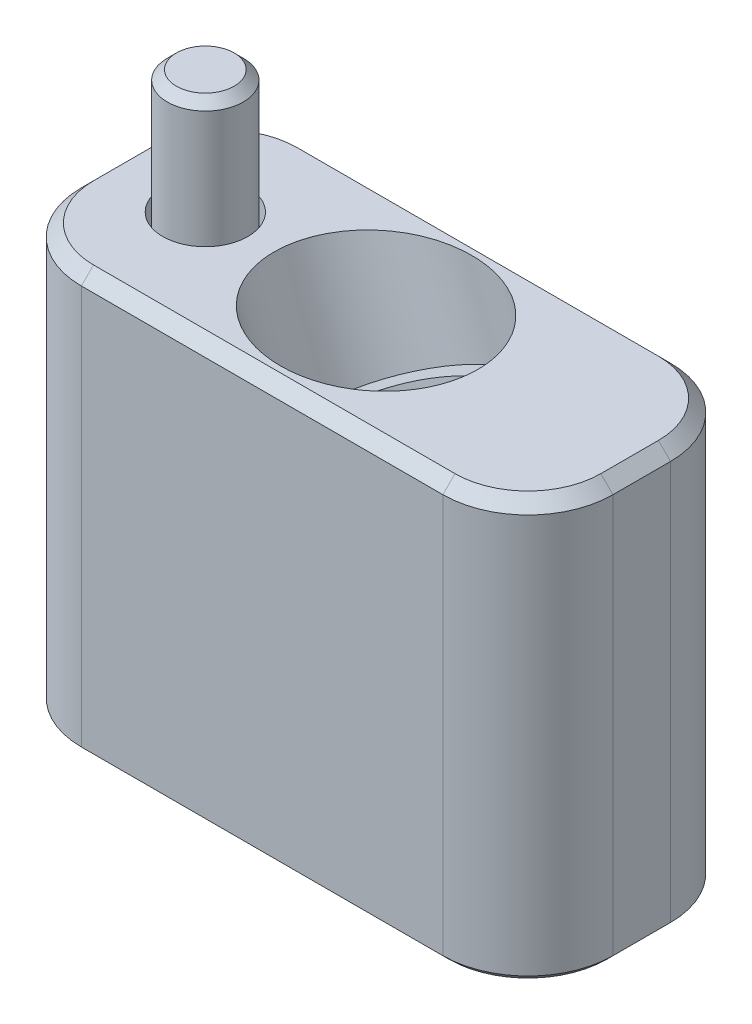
SolidWorks part; units mm, degrees
other "<SHCS25-20L1.50>-<Chamfer2>"
ref_plane "Front Plane" through (0, 0, 0) normal (0, 0, 1) x (1, 0, 0)
ref_plane "Top Plane" through (0, 0, 0) normal (0, 1, 0) x (1, 0, 0)
ref_plane "Right Plane" through (0, 0, 0) normal (1, 0, 0) x (0, 0, -1)
sketch "Sketch1" plane through (0, 0, 0) normal (0, 1, 0) x (1, 0, 0)
  line L1 (15.1003, -9.5186) -> (-15.113, -9.5186)
  line L2 (22.2123, -2.4066) -> (22.2123, 2.4067)
  line L3 (15.1003, 9.5187) -> (-15.113, 9.5186)
  line L4 (-22.225, -2.4066) -> (-22.225, 2.4066)
  line L5 (22.2123, -9.5186) -> (-22.225, 9.5186) construction
  line L6 (22.2123, 9.5187) -> (-22.225, -9.5187) construction
  arc A0 (15.1003, 9.5187) -> (22.2123, 2.4067) centre (15.1003, 2.4067) cw
  arc A1 (22.2123, -2.4066) -> (15.1003, -9.5186) centre (15.1003, -2.4066) cw
  arc A2 (-15.113, -9.5186) -> (-22.225, -2.4066) centre (-15.113, -2.4066) cw
  arc A3 (-22.225, 2.4066) -> (-15.113, 9.5186) centre (-15.113, 2.4066) cw
  point P0 (-0.0064, 0)
  dimension "D3" = 7.112
  dimension "D1" = 19.0373
  dimension "D2" = 44.4373
  dimension "D4" = 22.225
extrude "Boss-Extrude1" add sketch "Sketch1" against normal blind 34.8996
sketch "Sketch2" plane through (0, 0, 0) normal (0, 0, 1) x (1, 0, 0)
  line L0 (0, 0) -> (2.5121, -6.902) construction
  line L1 (-15.113, 0) -> (15.1003, 0) construction
  line L3 (0, -10.4705) -> (0, 10.4705) construction
  line L4 (-3.5178, -8.9569) -> (-5.0513, -9.5151)
  line L5 (-5.0513, -9.5151) -> (-18.2203, 26.6666)
  line L6 (-10.7018, 29.4031) -> (-18.2203, 26.6666)
  line L7 (-3.5178, -8.9569) -> (9.1724, -43.8228)
  line L8 (9.1724, -43.8228) -> (15.9502, -43.8228)
  line L9 (15.9502, -43.8228) -> (-10.7018, 29.4031)
  dimension "D1" = 20
  dimension "D2" = 12.7381
  dimension "D3" = 7.2136
  dimension "D4" = 8.001
revolve "Cut-Revolve1" cut sketch "Sketch2" angle 360 about L0
chamfer "Chamfer1" distance 1.016 angle 45 8 edges at (-0.0064, 0, -9.5186) (-20.1419, 0, -7.4356) (20.1292, 0, -7.4356) (-22.225, 0, 0) (22.2123, 0, 0) (-20.1419, 0, 7.4356) (20.1292, 0, 7.4356) (-0.0063, 0, 9.5186)
hole_wizard "CBORE for 1/4 Socket Head Cap Screw1" positions "Sketch3" profile "Sketch4" counterbore size "1/4" standard "ANSI Inch"
sketch "Sketch3" plane through (0, -34.8996, 0) normal (0, 1, 0) x (1, 0, 0)
  line L1 (-22.225, 2.4066) -> (-22.225, -2.4066) construction
  point P0 (-14.2748, 0)
  dimension "D1" = 7.9502
sketch "Sketch4" plane through (-14.2748, -34.8996, 0) normal (1, 0, 0) x (0, 0, -1)
  line L0 (0, 0) -> (0, 34.8996)
  line L1 (0, 34.8996) -> (3.556, 34.8996)
  line L3 (3.556, 34.8996) -> (3.556, 7.112)
  line L4 (3.556, 7.112) -> (5.1562, 7.112)
  line L5 (5.1562, 7.112) -> (5.1562, 0)
  line L7 (5.1562, 0) -> (0, 0)
  line L11 (0, -6.35) -> (0, 107.95) construction
  dimension "Thru Hole Dia." = 7.112
  dimension "Thru Hole Depth" = 34.8996
  dimension "C'Bore Dia." = 10.3124
  dimension "C'Bore Depth" = 7.112
hole_wizard "5/16-18 Tapped Hole2" positions "Sketch7" profile "Sketch8" tap size "5/16-18" standard "ANSI Inch"
sketch "Sketch7" plane through (0, -27.7876, 0) normal (0, -1, 0) x (-1, 0, 0)
  point P0 (14.2748, 0)
sketch "Sketch8" plane through (-14.2748, -27.7876, 0) normal (1, 0, 0) x (0, 0, -1)
  line L0 (0, 0) -> (0, 17.8923)
  line L1 (0, 17.8923) -> (3.5687, 15.748)
  line L2 (3.5687, 15.748) -> (3.5687, 0)
  line L5 (3.5687, 0) -> (0, 0)
  line L10 (0, 17.8923) -> (-3.5687, 15.748) construction
  line L11 (0, -6.35) -> (0, 107.95) construction
  dimension "Tap Drill Dia." = 7.1374
  dimension "Tap Drill Depth" = 15.748
  dimension "Drill Angle" = 118
chamfer "Chamfer2" distance 0.508 angle 45 8 edges at (-0.0064, -34.8996, -9.5186) (-20.1419, -34.8996, -7.4356) (20.1292, -34.8996, -7.4356) (-22.225, -34.8996, 0) (22.2123, -34.8996, 0) (-20.1419, -34.8996, 7.4356) (20.1292, -34.8996, 7.4356) (-0.0063, -34.8996, 9.5186)
inserted part "SHCS25-20L1.50"
move or copy body "Body-Move/Copy2" placed by mates yes
